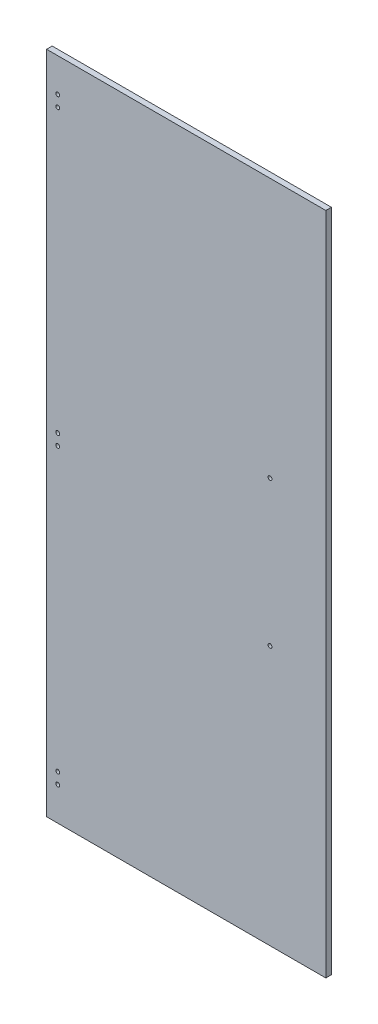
SolidWorks part; units mm, degrees
ref_plane "Alzado" through (0, 0, 0) normal (0, 0, 1) x (1, 0, 0)
ref_plane "Planta" through (0, 0, 0) normal (0, 1, 0) x (1, 0, 0)
ref_plane "Vista lateral" through (0, 0, 0) normal (1, 0, 0) x (0, 0, -1)
sketch "Sketch1" plane through (0, 0, 0) normal (0, 0, 1) x (1, 0, 0)
  line L1 (-125, -297.5) -> (125, -297.5)
  line L2 (-125, -297.5) -> (-125, 297.5)
  line L3 (-125, 297.5) -> (125, 297.5)
  line L4 (125, -297.5) -> (125, 297.5)
  line L5 (-125, -297.5) -> (125, 297.5) construction
  line L6 (-125, 297.5) -> (125, -297.5) construction
  point P0 (0, 0)
  dimension "D1" = 250
  dimension "D2" = 595
extrude "Boss-Extrude1" add sketch "Sketch1" along normal blind 5
sketch "Sketch2" plane through (0, 0, 5) normal (0, 0, 1) x (1, 0, 0)
  line L0 (125, -65) -> (75, -65) construction
  line L1 (125, -297.5) -> (125, 297.5) construction
  line L2 (75, -65) -> (75, 65) construction
  line L3 (0, 0) -> (75, 0) construction
  line L4 (-125, -297.5) -> (-115, -297.5) construction
  line L5 (-125, -297.5) -> (125, -297.5) construction
  line L6 (-115, -297.5) -> (-115, -267.5) construction
  line L7 (-115, -267.5) -> (-115, -257.5) construction
  line L8 (-115, -262.5) -> (-115, 0) construction
  line L9 (-115, -131.25) -> (-89.7071, -131.25) construction
  line L10 (-115, 0) -> (-102.7465, 0) construction
  circle A0 centre (75, 65) radius 1.75
  circle A1 centre (75, -65) radius 1.75
  circle A2 centre (-115, -267.5) radius 1.75
  circle A3 centre (-115, -257.5) radius 1.75
  circle A4 centre (-115, -5) radius 1.75
  circle A5 centre (-115, 5) radius 1.75
  circle A6 centre (-115, 267.5) radius 1.75
  circle A7 centre (-115, 257.5) radius 1.75
  dimension "D2" = 3.5
  dimension "D3" = 3.5
  dimension "D8" = 3.5
  dimension "D1" = 50
  dimension "D4" = 130
  dimension "D5" = 10
  dimension "D6" = 30
  dimension "D7" = 10
extrude "Cut-Extrude1" cut sketch "Sketch2" against normal blind 30
